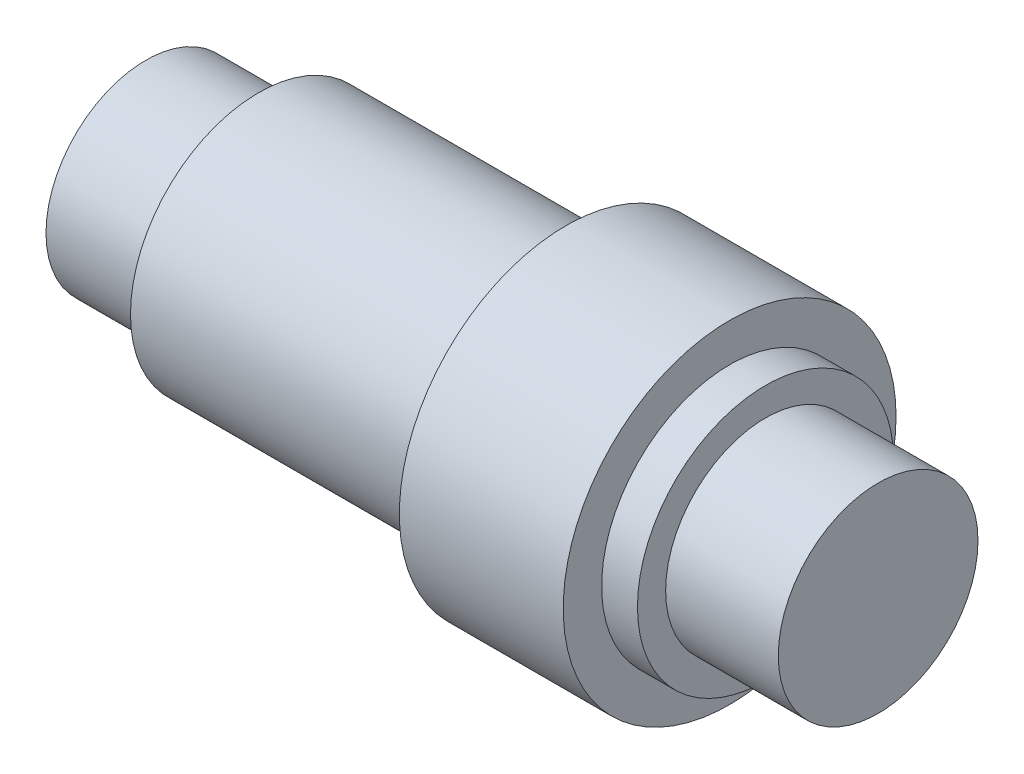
SolidWorks part; units mm, degrees
ref_plane "Plano frontal" through (0, 0, 0) normal (0, 0, 1) x (1, 0, 0)
ref_plane "Plano superior" through (0, 0, 0) normal (0, 1, 0) x (1, 0, 0)
ref_plane "Plano direito" through (0, 0, 0) normal (1, 0, 0) x (0, 0, -1)
sketch "Esboço1" plane through (0, 0, 0) normal (1, 0, 0) x (0, 0, -1)
  circle A0 centre (0, 0) radius 1.95
  dimension "D1" = 3.9
extrude "Ressalto-extrusão1" add sketch "Esboço1" along normal mid plane 14.3
ref_plane "Plano2" through (2.65, 0, 0) normal (1, 0, 0) x (0, 0, -1)
ref_plane "Plano1" through (-4.95, 0, 0) normal (-1, 0, 0) x (0, 0, 1)
sketch "Esboço3" plane through (2.65, 0, 0) normal (1, 0, 0) x (0, 0, -1)
  circle A0 centre (0, 0) radius 3.25
  dimension "D1" = 6.5
extrude "Ressalto-extrusão3" add sketch "Esboço3" along normal mid plane 3.2
sketch "Esboço2" plane through (-4.95, 0, 0) normal (-1, 0, 0) x (0, 0, 1)
  circle A0 centre (0, 0) radius 2.5
  circle A1 centre (0, 0) radius 1.95 construction
  point P2 (0, 0)
  dimension "D1" = 5
extrude "Ressalto-extrusão2" add sketch "Esboço2" against normal up to next
mirror "Espelhar1" about plane through (0, 0, 0) normal (1, 0, 0) of "Ressalto-extrusão2"
